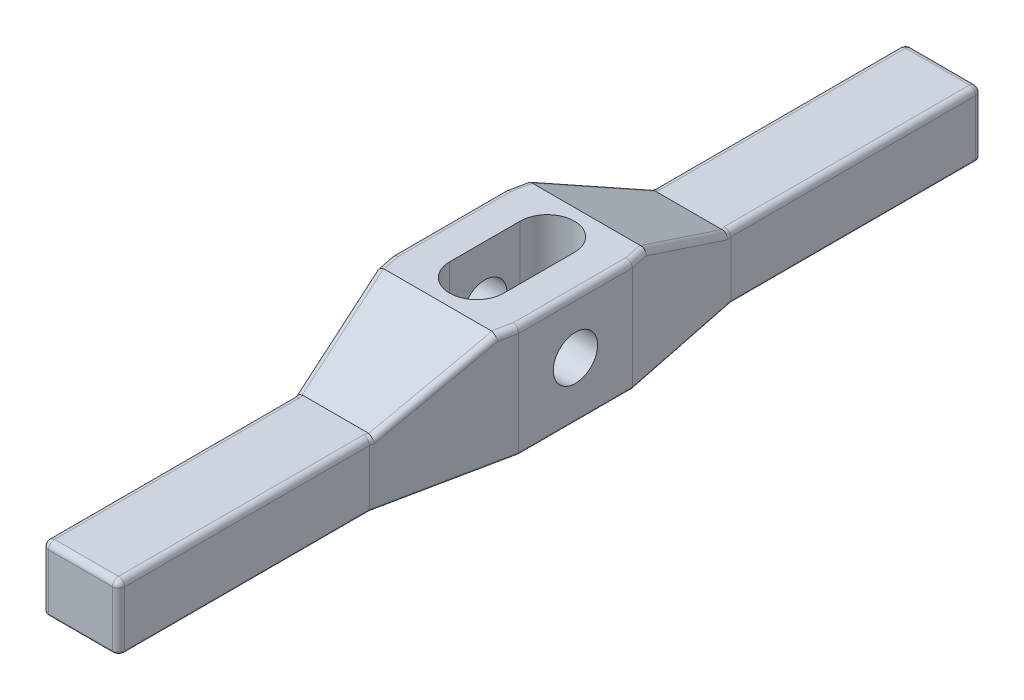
SolidWorks part; units mm, degrees
ref_plane "Front Plane" through (0, 0, 0) normal (0, 0, 1) x (1, 0, 0)
ref_plane "Top Plane" through (0, 0, 0) normal (0, 1, 0) x (1, 0, 0)
ref_plane "Right Plane" through (0, 0, 0) normal (1, 0, 0) x (0, 0, -1)
sketch "Sketch1" plane through (0, 0, 0) normal (0, 1, 0) x (1, 0, 0)
  line L0 (0, 0) -> (68.8474, 0) construction
  line L1 (0, 0) -> (0, 75.643) construction
  line L2 (-9.525, 107.95) -> (9.525, 107.95)
  line L3 (9.525, 107.95) -> (9.525, 45.212)
  line L4 (9.525, 45.212) -> (15.875, 14.2245)
  line L5 (15.875, 14.2245) -> (15.875, -14.2245)
  line L6 (9.525, -45.212) -> (15.875, -14.2245)
  line L7 (9.525, -107.95) -> (9.525, -45.212)
  line L8 (-9.525, -107.95) -> (9.525, -107.95)
  line L9 (-9.525, -107.95) -> (-9.525, -45.212)
  line L10 (-9.525, -45.212) -> (-15.875, -14.2245)
  line L11 (-15.875, 14.2245) -> (-15.875, -14.2245)
  line L12 (-9.525, 45.212) -> (-15.875, 14.2245)
  line L13 (-9.525, 107.95) -> (-9.525, 45.212)
  line L14 (-6.7818, 8.8265) -> (-6.7818, -8.8265)
  line L15 (6.7818, 8.8265) -> (6.7818, -8.8265)
  arc A0 (6.7818, 8.8265) -> (-6.7818, 8.8265) centre (0, 8.8265) ccw
  arc A1 (-6.7818, -8.8265) -> (6.7818, -8.8265) centre (0, -8.8265) ccw
  dimension "D1" = 19.05
  dimension "D2" = 215.9
  dimension "D3" = 31.75
  dimension "D4" = 62.738
  dimension "D5" = 28.449
  dimension "D6" = 17.653
  dimension "D7" = 13.5636
extrude "Extrude1" add sketch "Sketch1" along normal blind 27.813
sketch "Sketch2" plane through (15.875, 0, 0) normal (1, 0, 0) x (0, 0, -1)
  line L0 (0, 0) -> (0, 25.2428) construction
  line L1 (-14.2245, 0) -> (14.2245, 0) construction
  line L2 (107.95, 27.813) -> (18.5674, 27.813)
  line L3 (14.2245, 27.813) -> (45.212, 27.813) construction
  line L4 (18.5674, 27.813) -> (44.1685, 15.875)
  line L5 (44.1685, 15.875) -> (107.95, 15.875)
  line L6 (107.95, 27.813) -> (107.95, 0) construction
  line L7 (107.95, 15.875) -> (107.95, 27.813)
  line L8 (45.212, 0) -> (107.95, 0) construction
  line L9 (-107.95, 15.875) -> (-107.95, 27.813)
  line L10 (-44.1685, 15.875) -> (-107.95, 15.875)
  line L11 (-18.5674, 27.813) -> (-44.1685, 15.875)
  line L12 (-107.95, 27.813) -> (-18.5674, 27.813)
  dimension "D1" = 18.5674
  dimension "D2" = 25
  dimension "D3" = 15.875
extrude "Cut-Extrude1" cut sketch "Sketch2" against normal through all
sketch "Sketch3" plane through (15.875, 0, 0) normal (1, 0, 0) x (0, 0, -1)
  line L0 (-14.2245, 0) -> (14.2245, 0) construction
  circle A0 centre (0, 13.9446) radius 5.5436
  dimension "D1" = 11.0871
  dimension "D2" = 13.9446
extrude "Cut-Extrude2" cut sketch "Sketch3" against normal through all
fillet "Fillet1" radius 1.524 4 edges at (-9.525, 7.9375, -107.95) (9.525, 7.9375, -107.95) (9.525, 7.9375, 107.95) (-9.525, 7.9375, 107.95)
fillet "Fillet2" radius 0.508 16 edges at (-9.525, 0, 75.819) (-9.0786, 0, 107.5036) (0, 0, 107.95) (9.0786, 0, 107.5036) (-9.525, 0, -75.819) (-9.0786, 0, -107.5036) (0, 0, -107.95) (9.0786, 0, -107.5036) (-12.7, 0, -29.7183) (-15.875, 0, 0) (-12.7, 0, 29.7183) (9.525, 0, 75.819) (12.7, 0, 29.7183) (15.875, 0, 0) (12.7, 0, -29.7183) (9.525, 0, -75.819)
fillet "Fillet3" radius 1.524 24 edges at (-9.0786, 15.875, 107.5036) (0, 15.875, 107.95) (9.0786, 15.875, 107.5036) (-9.525, 15.875, -75.819) (-9.0786, 15.875, -107.5036) (0, 15.875, -107.95) (9.0786, 15.875, -107.5036) (-9.6319, 15.875, -44.6903) (-12.3619, 21.844, -31.368) (-15.43, 27.813, -16.396) (-15.43, 27.813, 16.396) (-15.875, 27.813, 0) (-12.3619, 21.844, 31.368) (-9.525, 15.875, 75.819) (-9.6319, 15.875, 44.6903) (9.525, 15.875, 75.819) (9.6319, 15.875, 44.6903) (12.3619, 21.844, 31.368) (15.43, 27.813, 16.396) (15.875, 27.813, 0) (15.43, 27.813, -16.396) (9.6319, 15.875, -44.6903) (12.3619, 21.844, -31.368) (9.525, 15.875, -75.819)
